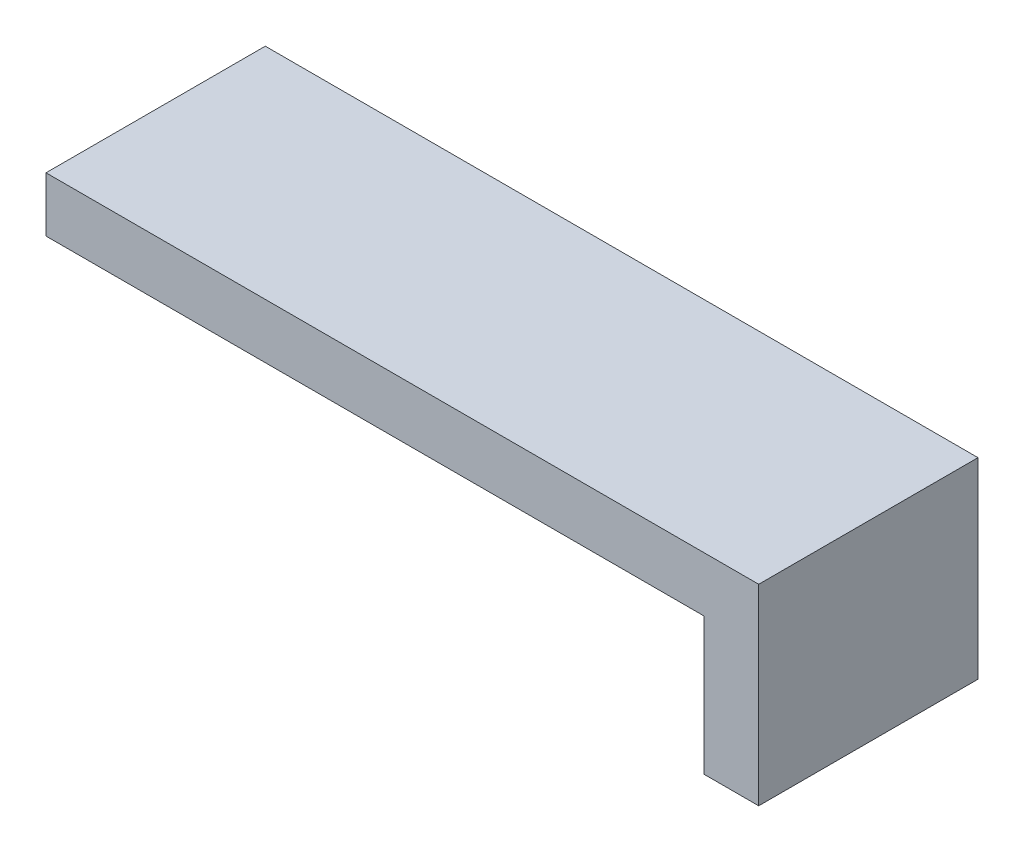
SolidWorks part; units mm, degrees
ref_plane "Alzado" through (0, 0, 0) normal (0, 0, 1) x (1, 0, 0)
ref_plane "Planta" through (0, 0, 0) normal (0, 1, 0) x (1, 0, 0)
ref_plane "Vista lateral" through (0, 0, 0) normal (1, 0, 0) x (0, 0, -1)
sketch "Croquis2" plane through (0, 0, 0) normal (0, 0, 1) x (1, 0, 0)
  line L1 (60, 5) -> (-60, 5)
  line L3 (60, -5) -> (-60, -5)
  line L4 (-60, 5) -> (-60, -5)
  line L7 (60, 5) -> (70, 5)
  line L8 (60, -5) -> (60, -30)
  line L9 (60, -30) -> (70, -30)
  line L10 (70, 5) -> (70, -30)
  point P0 (0, 0)
  dimension "D1" = 10
  dimension "D2" = 120
  dimension "D3" = 10
  dimension "D4" = 35
extrude "Saliente-Extruir1" add sketch "Croquis2" along normal mid plane 40
